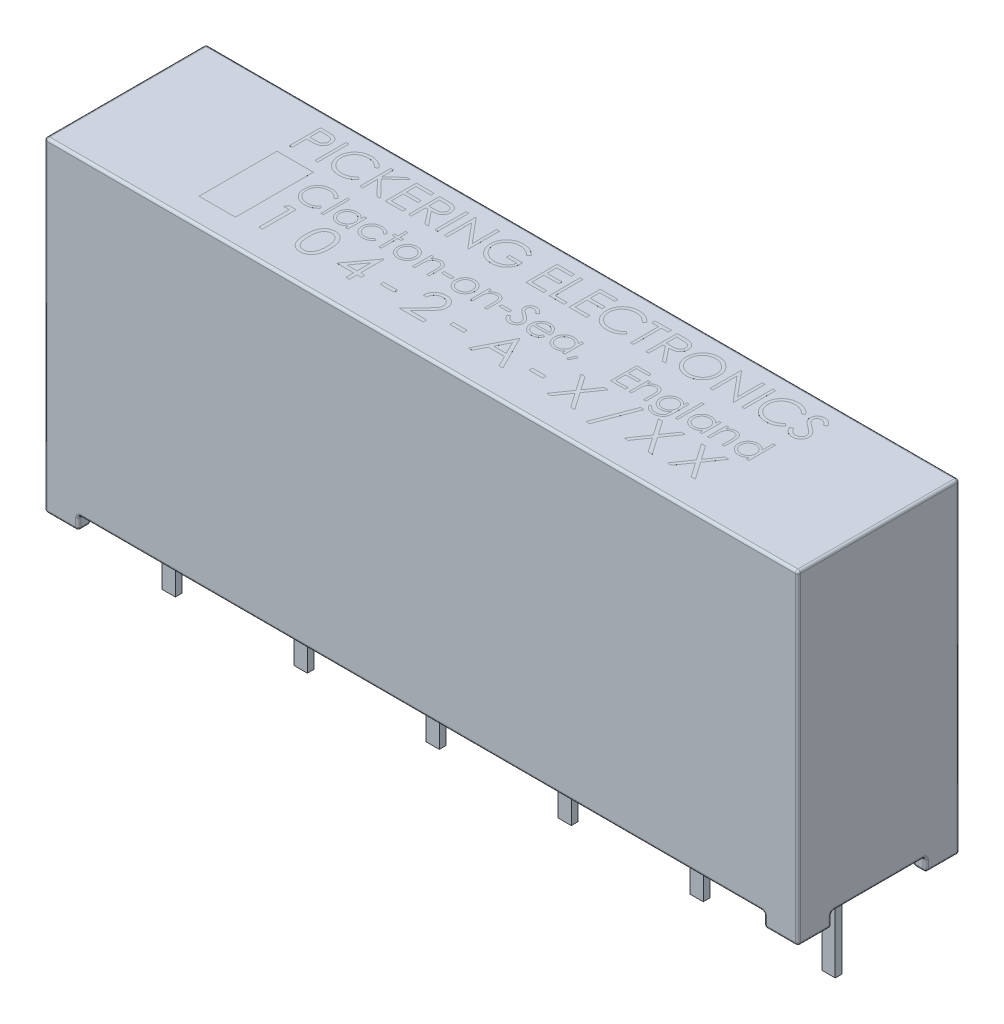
SolidWorks part; units mm, degrees
ref_plane "Front Plane" through (0, 0, 0) normal (0, 0, 1) x (1, 0, 0)
ref_plane "Top Plane" through (0, 0, 0) normal (0, 1, 0) x (1, 0, 0)
ref_plane "Right Plane" through (0, 0, 0) normal (1, 0, 0) x (0, 0, -1)
sketch "Sketch1" plane through (0, 0, 0) normal (0, 1, 0) x (1, 0, 0)
  line L1 (14.5, -3.11) -> (-14.5, -3.11)
  line L2 (14.5, -3.11) -> (14.5, 3.11)
  line L3 (14.5, 3.11) -> (-14.5, 3.11)
  line L4 (-14.5, -3.11) -> (-14.5, 3.11)
  line L5 (14.5, -3.11) -> (-14.5, 3.11) construction
  line L6 (14.5, 3.11) -> (-14.5, -3.11) construction
  point P0 (0, 0)
  dimension "D1" = 6.22
  dimension "D2" = 29
extrude "Main Body" add sketch "Sketch1" along normal blind 11.992
sketch "Sketch2" plane through (0, 0, 0) normal (0, -1, 0) x (1, 0, 0)
  line L1 (-14.5, 3.11) -> (-13.2, 3.11)
  line L2 (-14.5, 3.11) -> (-14.5, 1.81)
  line L3 (-14.5, 1.81) -> (-14, 1.81)
  line L4 (-13.2, 3.11) -> (-13.2, 2.61)
  line L7 (-13.2, 2.61) -> (-14, 2.61)
  line L8 (-14, 1.81) -> (-14, 2.61)
  dimension "D1" = 1.3
  dimension "D2" = 1.3
  dimension "D3" = 0.5
  dimension "D4" = 0.5
extrude "Original foot" add sketch "Sketch2" along normal blind 0.508
mirror "Left foot" about plane through (0, 0, 0) normal (0, 0, 1) of "Original foot"
mirror "Right Feet" about plane through (0, 0, 0) normal (1, 0, 0) of "Left foot", "Original foot"
sketch "Sketch3" plane through (0, 0, 0) normal (0, -1, 0) x (1, 0, 0)
  line L1 (-12.446, -0.127) -> (-12.954, -0.127)
  line L2 (-12.446, -0.127) -> (-12.446, 0.127)
  line L3 (-12.446, 0.127) -> (-12.954, 0.127)
  line L4 (-12.954, -0.127) -> (-12.954, 0.127)
  line L5 (-12.446, -0.127) -> (-12.954, 0.127) construction
  line L6 (-12.446, 0.127) -> (-12.954, -0.127) construction
  line L7 (-2.794, -0.127) -> (-2.286, -0.127)
  line L8 (-2.794, -0.127) -> (-2.794, 0.127)
  line L9 (-2.794, 0.127) -> (-2.286, 0.127)
  line L10 (-2.286, -0.127) -> (-2.286, 0.127)
  line L11 (-2.794, -0.127) -> (-2.286, 0.127) construction
  line L12 (-2.794, 0.127) -> (-2.286, -0.127) construction
  line L13 (12.954, -0.127) -> (12.446, -0.127)
  line L14 (12.954, -0.127) -> (12.954, 0.127)
  line L15 (12.954, 0.127) -> (12.446, 0.127)
  line L16 (12.446, -0.127) -> (12.446, 0.127)
  line L17 (12.954, -0.127) -> (12.446, 0.127) construction
  line L18 (12.954, 0.127) -> (12.446, -0.127) construction
  line L19 (2.286, -0.127) -> (2.794, -0.127)
  line L20 (2.286, -0.127) -> (2.286, 0.127)
  line L21 (2.286, 0.127) -> (2.794, 0.127)
  line L22 (2.794, -0.127) -> (2.794, 0.127)
  line L23 (2.286, -0.127) -> (2.794, 0.127) construction
  line L24 (2.286, 0.127) -> (2.794, -0.127) construction
  line L27 (7.366, -0.127) -> (7.874, -0.127)
  line L28 (7.366, -0.127) -> (7.366, 0.127)
  line L29 (7.366, 0.127) -> (7.874, 0.127)
  line L30 (7.874, -0.127) -> (7.874, 0.127)
  line L31 (7.366, -0.127) -> (7.874, 0.127) construction
  line L32 (7.366, 0.127) -> (7.874, -0.127) construction
  line L33 (-7.366, -0.127) -> (-7.874, -0.127)
  line L34 (-7.366, -0.127) -> (-7.366, 0.127)
  line L35 (-7.366, 0.127) -> (-7.874, 0.127)
  line L36 (-7.874, -0.127) -> (-7.874, 0.127)
  line L37 (-7.366, -0.127) -> (-7.874, 0.127) construction
  line L38 (-7.366, 0.127) -> (-7.874, -0.127) construction
  line L40 (-14.5, -1.81) -> (-14.5, 1.81) construction
  point P0 (-12.7, 0)
  point P5 (-2.54, 0)
  point P10 (12.7, 0)
  point P15 (2.54, 0)
  point P20 (7.62, 0)
  point P26 (-7.62, 0)
  dimension "D1" = 0.508
  dimension "D2" = 0.254
  dimension "D3" = 0.508
  dimension "D4" = 0.254
  dimension "D5" = 0.508
  dimension "D6" = 0.254
  dimension "D7" = 0.508
  dimension "D8" = 0.254
  dimension "D9" = 5.08
  dimension "D10" = 5.08
  dimension "D11" = 5.08
  dimension "D12" = 0.508
  dimension "D13" = 0.254
  dimension "D14" = 5.08
  dimension "D15" = 0.254
  dimension "D16" = 0.508
  dimension "D17" = 5.08
  dimension "D18" = 1.8
extrude "Pins" add sketch "Sketch3" along normal blind 3.808
sketch "Sketch4"
  dimension "D1" = 19.3
  dimension "D2" = 17.5
  dimension "D3" = 17.5
  dimension "D4" = 1.8
  dimension "D5" = 1.65
  dimension "D6" = 1.65
  dimension "D7" = 4.85
  dimension "D8" = 3
  dimension "D9" = 1.4
  dimension "D10" = 4.95
  dimension "D11" = 1
extrude "Lettering" add sketch "Sketch4" along normal blind 0.0001
fillet "Fillet1" radius 0.1 72 edges at (14, -0.254, -1.81) (14.5, -0.254, -1.81) (14.5, -0.254, 1.81) (14, -0.254, 1.81) (13.6, 0, -2.61) (14.25, 0, -1.81) (14.25, 0, 1.81) (13.6, 0, 2.61) (-13.6, 0, 2.61) (-13.6, 0, -2.61) (-13.6, -0.508, -2.61) (-13.85, -0.508, -3.11) (-14.5, -0.508, -2.46) (13.2, -0.254, -2.61) (13.2, -0.254, -3.11) (13.2, 0, -2.86) (14, -0.254, -2.61) (14, 0, -2.21) (14, -0.254, 2.61) (14, 0, 2.21) (13.2, -0.254, 2.61) (13.2, -0.254, 3.11) (13.2, 0, 2.86) (-14, -0.254, 1.81) (-14, -0.254, 2.61) (-14, 0, 2.21) (-13.2, -0.254, 2.61) (-14.25, -0.508, -1.81) (-14.5, -0.254, -1.81) (-14, -0.254, -1.81) (-14.25, 0, -1.81) (-14, -0.254, -2.61) (-14, -0.508, -2.21) (-14, 0, -2.21) (-13.2, -0.254, -2.61) (-13.2, -0.254, -3.11) (-13.2, -0.508, -2.86) (-13.2, 0, -2.86) (-13.85, -0.508, 3.11) (-13.2, -0.508, 2.86) (-13.6, -0.508, 2.61) (-14, -0.508, 2.21) (-14.25, -0.508, 1.81) (-14.5, -0.508, 2.46) (13.85, -0.508, -3.11) (13.2, -0.508, -2.86) (13.6, -0.508, -2.61) (14, -0.508, -2.21) (14.25, -0.508, -1.81) (14.5, -0.508, -2.46) (14.25, -0.508, 1.81) (14, -0.508, 2.21) (13.6, -0.508, 2.61) (13.2, -0.508, 2.86) (13.85, -0.508, 3.11) (14.5, -0.508, 2.46) (14.5, 0, 0) (0, 0, -3.11) (0, 11.992, -3.11) (14.5, 5.742, -3.11) (14.5, 11.992, 0) (14.5, 5.742, 3.11) (0, 11.992, 3.11) (-14.5, 11.992, 0) (-14.5, 5.742, -3.11) (-14.5, 5.742, 3.11)
